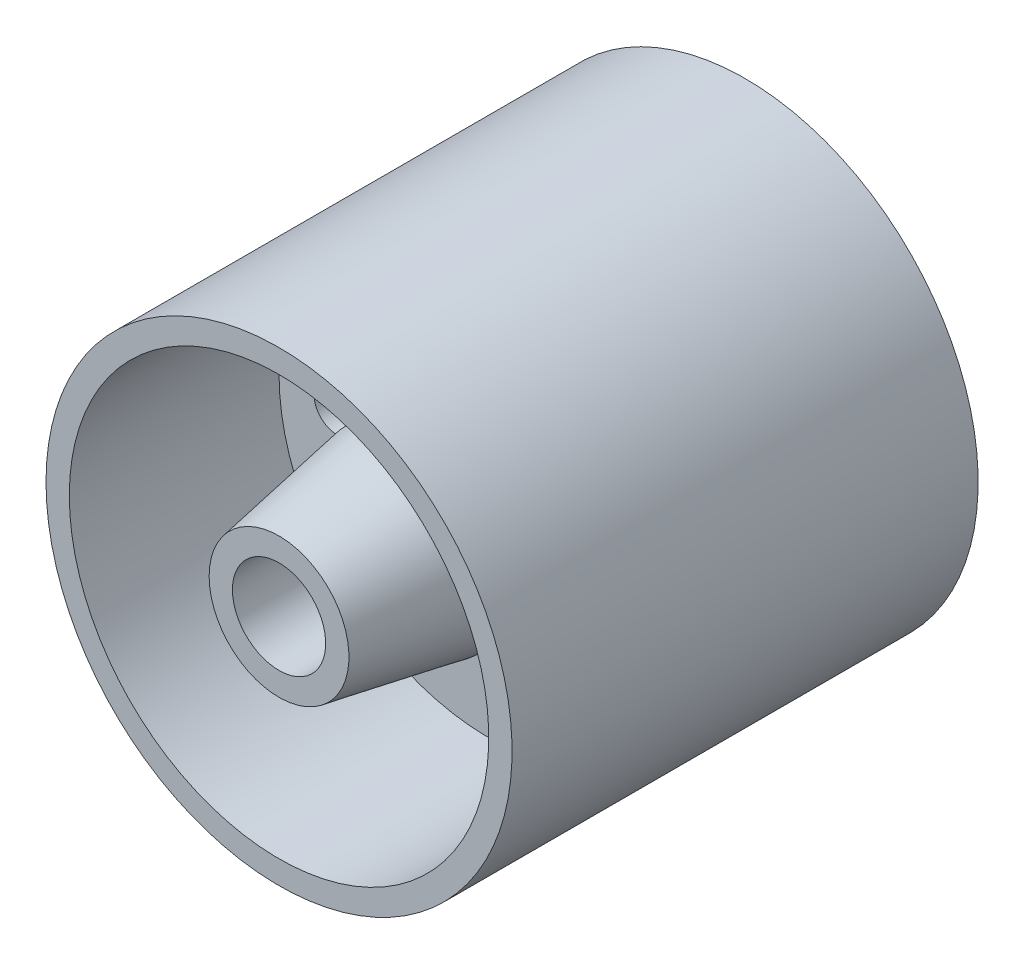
SolidWorks part; units mm, degrees
ref_plane "Front Plane" through (0, 0, 0) normal (0, 0, 1) x (1, 0, 0)
ref_plane "Top Plane" through (0, 0, 0) normal (0, 1, 0) x (1, 0, 0)
ref_plane "Right Plane" through (0, 0, 0) normal (1, 0, 0) x (0, 0, -1)
sketch "Sketch1" plane through (0, 0, 0) normal (1, 0, 0) x (0, 0, -1)
  line L0 (0, 0) -> (-63.3626, 0) construction
  line L1 (0, 10) -> (-50, 10)
  line L2 (0, 0) -> (0, 65.1118) construction
  line L3 (-50, 10) -> (-50, 15)
  line L4 (-50, 15) -> (-21.6436, 20)
  line L5 (-21.6436, 20) -> (-5, 20)
  line L6 (-5, 20) -> (-5, 45)
  line L7 (-5, 45) -> (-50, 45)
  line L8 (-50, 45) -> (-50, 50)
  line L9 (-50, 50) -> (0, 50)
  line L10 (0, 50) -> (0, 10)
  dimension "D1" = 20
  dimension "D2" = 10
  dimension "D3" = 50
  dimension "D4" = 5
  dimension "D5" = 10
  dimension "D6" = 5
  dimension "D7" = 5
  dimension "D8" = 40
revolve "Revolve1" add sketch "Sketch1" angle 360 about L0
mirror "Mirror1" about plane through (0, 50, 0) normal (0, 0, -1)
hole_wizard "Ø10.0 (10) Diameter Hole1" positions "Sketch3" profile "Sketch4" hole size "Ø10.0" standard "Ansi Metric"
sketch "Sketch3" plane through (0, 0, 5) normal (0, 0, 1) x (1, 0, 0)
  line L0 (20, 0) -> (45, 0) construction
  line L1 (0, -20) -> (0, -45) construction
  circle A0 centre (0, 0) radius 20 construction
  circle A1 centre (0, 0) radius 45 construction
  circle A2 centre (0, 0) radius 45 construction
  point P0 (32.5, 0)
sketch "Sketch4" plane through (32.5, 0, 5) normal (1, 0, 0) x (0, -1, 0)
  line L0 (0, 0) -> (0, 10.001)
  line L1 (0, 10.001) -> (5, 10.001)
  line L2 (5, 10.001) -> (5, 0)
  line L5 (5, 0) -> (0, 0)
  line L11 (0, -6.35) -> (0, 107.95) construction
  dimension "Thru Hole Dia." = 10
  dimension "Thru Hole Depth" = 10.001
pattern_circular "CirPattern1" count 6 over 360 about axis through (0, 0, 0) along (0, 0, 1) of "Ø10.0 (10) Diameter Hole1"
